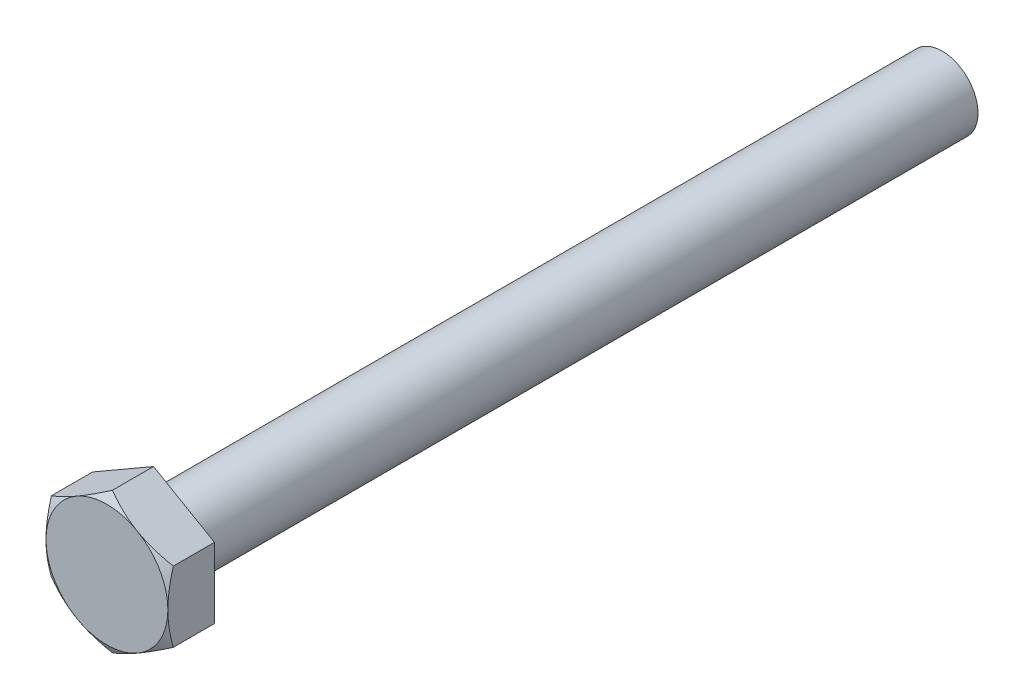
SolidWorks part; units mm, degrees
ref_plane "Front Plane" through (0, 0, 0) normal (0, 0, 1) x (1, 0, 0)
ref_plane "Top Plane" through (0, 0, 0) normal (0, 1, 0) x (1, 0, 0)
ref_plane "Right Plane" through (0, 0, 0) normal (1, 0, 0) x (0, 0, -1)
sketch "Sketch1" plane through (0, 0, 0) normal (0, 0, 1) x (1, 0, 0)
  circle A0 centre (0, 0) radius 10
  dimension "D1" = 20
extrude "Boss-Extrude1" add sketch "Sketch1" along normal mid plane 220
sketch "Sketch3" plane through (0, 0, 110) normal (0, 0, 1) x (1, 0, 0)
  line L1 (17, -9.815) -> (17, 9.815)
  line L2 (17, 9.815) -> (0, 19.6299)
  line L3 (0, 19.6299) -> (-17, 9.815)
  line L4 (-17, 9.815) -> (-17, -9.815)
  line L5 (-17, -9.815) -> (0, -19.6299)
  line L6 (0, -19.6299) -> (17, -9.815)
  circle A0 centre (0, 0) radius 17 construction
  dimension "D1" = 34
extrude "Boss-Extrude2" add sketch "Sketch3" along normal blind 13
sketch "Sketch4" plane through (0, 0, 123) normal (0, 0, 1) x (1, 0, 0)
  line L0 (17, 9.815) -> (0, 19.6299) construction
  circle A0 centre (0, 0) radius 17
extrude "Cut-Extrude6" cut sketch "Sketch4" against normal through all draft 60 flip side to cut contours A0
